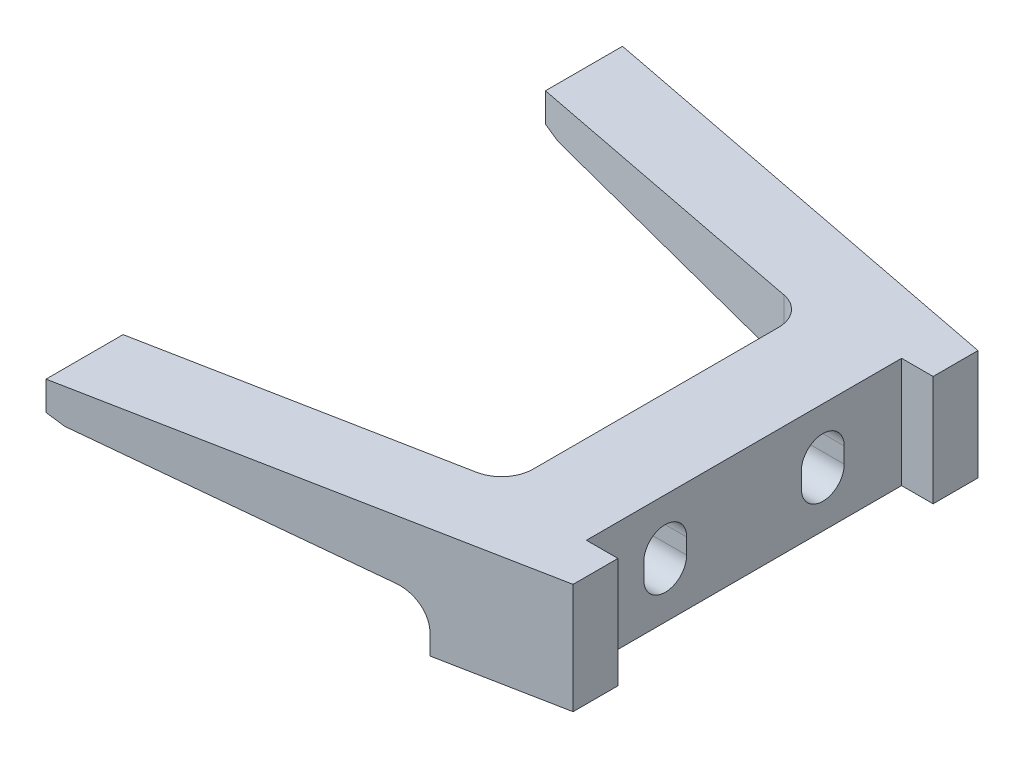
SolidWorks part; units mm, degrees
ref_plane "Front" through (0, 0, 0) normal (0, 0, 1) x (1, 0, 0)
ref_plane "Top" through (0, 0, 0) normal (0, 1, 0) x (1, 0, 0)
ref_plane "Right" through (0, 0, 0) normal (1, 0, 0) x (0, 0, -1)
sketch "Sketch1" plane through (0, 0, 0) normal (0, 0, 1) x (1, 0, 0)
  line L0 (0, -5.7912) -> (-35.56, -2.6801)
  line L1 (0, 0) -> (0, -5.7912)
  line L3 (-35.56, -2.6801) -> (-35.56, 0)
  line L4 (-35.56, 0) -> (0, 0)
  dimension "D1" = 35.56
  dimension "D2" = 5.7912
  dimension "D3" = 5
extrude "Extrude1" add sketch "Sketch1" along normal blind 25.4
sketch "Sketch3" plane through (0, 0, 0) normal (0, 1, 0) x (1, 0, 0)
  line L0 (0, -16.3159) -> (-46.7335, -25.4)
  line L1 (0, -25.4) -> (0, 0) construction
  line L2 (0, -25.4) -> (-35.56, -25.4) construction
  line L3 (-35.56, -17.018) -> (-9.652, -11.982)
  line L4 (-35.56, -25.4) -> (-35.56, 0) construction
  line L5 (-9.652, -11.982) -> (-9.652, 0)
  line L6 (0, 0) -> (-35.56, 0) construction
  line L7 (-9.652, 0) -> (-35.56, 0)
  line L8 (-35.56, -17.018) -> (-35.56, 0)
  line L9 (-46.7335, -25.4) -> (0, -25.4)
  line L10 (0, -25.4) -> (0, -16.3159)
  dimension "D1" = 6.096
  dimension "D2" = 17.018
  dimension "D3" = 9.652
  dimension "D5" = 79
extrude "Cut-Extrude1" cut sketch "Sketch3" against normal through all
mirror "Mirror1" about plane through (0, 0, 0) normal (0, 0, 1) of "Cut-Extrude1", "Extrude1"
sketch "Sketch4" plane through (0, 0, 0) normal (1, 0, 0) x (0, 0, -1)
  line L0 (-16.3159, 0) -> (16.3159, 0) construction
  line L5 (12.7, -9.7092) -> (0, -9.7092)
  line L6 (12.7, -9.7092) -> (12.7, 0)
  line L7 (12.7, 0) -> (0, 0)
  line L8 (0, -9.7092) -> (0, 0)
  dimension "D1" = 12.7
extrude "Cut-Extrude2" cut sketch "Sketch4" against normal blind 2.54
mirror "Mirror2" about plane through (0, 0, 0) normal (0, 0, 1) of "Cut-Extrude2"
sketch "Sketch7" plane through (0, 0, 0) normal (0, 1, 0) x (-1, 0, 0)
  line L0 (9.652, 11.982) -> (9.652, -11.982) construction
  line L1 (9.652, 18.1921) -> (0, 16.3159)
  line L2 (9.652, 18.1921) -> (9.652, 0)
  line L3 (9.652, 0) -> (2.54, 0)
  line L4 (2.54, 12.7) -> (2.54, 0)
  line L5 (2.54, -12.7) -> (2.54, 12.7) construction
  line L7 (0, 16.3159) -> (35.56, 23.2281) construction
  line L8 (2.54, 12.7) -> (0, 12.7)
  line L9 (0, 12.7) -> (0, 16.3159)
extrude "Extrude2" add sketch "Sketch7" against normal blind 8.89
fillet "Fillet3" radius 2.54 1 edges at (-9.652, -4.9468, 15.087)
mirror "Mirror3" about plane through (0, 0, 0) normal (0, 0, 1) of "Fillet3", "Extrude2"
chamfer "Chamfer1" distance 1.27 angle 15 2 edges at (-35.56, -2.6801, 20.123) (-35.56, -2.6801, -20.123)
fillet "Fillet1" radius 2.54 4 edges at (-10.3193, -5.5582, 12.1117) (-9.652, -3.6371, 11.982) (-9.652, -3.6371, -11.982)
hole_wizard "CBORE for #5 Socket Head Cap Screw2" positions "Sketch9" profile "Sketch8" counterbore size "#5" standard "Ansi Inch"
sketch "Sketch9" plane through (-9.652, 0, 0) normal (-1, 0, 0) x (0, 0, 1)
  line L0 (0, 0) -> (0, -8.89) construction
  line L1 (-17.0206, -8.89) -> (17.0206, -8.89) construction
  line L2 (-8.382, -4.445) -> (8.382, -4.445) construction
  point P0 (-8.382, -4.445)
  point P1 (8.382, -4.445)
  point P8 (0, -4.445)
  dimension "D1" = 16.764
sketch "Sketch8" plane through (-9.652, -4.445, -8.382) normal (0, 1, 0) x (0, 0, 1)
  line L0 (0, 0) -> (0, 9.652)
  line L1 (0, 9.652) -> (1.7272, 9.652)
  line L3 (1.7272, 9.652) -> (1.7272, 4.064)
  line L4 (1.7272, 4.064) -> (3.175, 4.064)
  line L5 (3.175, 4.064) -> (3.175, 0)
  line L7 (3.175, 0) -> (0, 0)
  line L11 (0, -6.35) -> (0, 107.95) construction
  dimension "Thru Hole Dia." = 3.4544
  dimension "Thru Hole Depth" = 9.652
  dimension "C'Bore Dia." = 6.35
  dimension "C'Bore Depth" = 4.064
sketch "Sketch10" [suppressed] plane through (-5.588, 0, 0) normal (-1, 0, 0) x (0, 0, 1)
  circle A0 centre (-8.382, -4.445) radius 3.175
  arc A1 (-9.4317, -7.4415) -> (-9.4317, -1.4485) centre (-8.382, -4.445) ccw construction
extrude "Cut-Extrude3" [suppressed] cut sketch "Sketch10" along normal through all
sketch "Sketch11" plane through (-2.54, 0, 0) normal (1, 0, 0) x (0, 0, -1)
  line L0 (-8.0772, -5.08) -> (-8.0772, -3.81)
  line L1 (-4.6228, -5.08) -> (-4.6228, -3.81)
  line L2 (-4.6228, 0) -> (-4.6228, -8.89) construction
  line L3 (12.7, 0) -> (-12.7, 0) construction
  line L4 (-12.7, -8.89) -> (12.7, -8.89) construction
  arc A0 (-8.0772, -5.08) -> (-4.6228, -5.08) centre (-6.35, -5.08) ccw
  arc A1 (-4.6228, -3.81) -> (-8.0772, -3.81) centre (-6.35, -3.81) ccw
  point P1 (-4.6228, -4.445)
  point P14 (-4.6228, -4.445)
  dimension "D1" = 3.4544
  dimension "D2" = 6.35
  dimension "D3" = 1.27
extrude "Cut-Extrude4" cut sketch "Sketch11" against normal through all
mirror "Mirror4" about plane through (0, 0, 0) normal (0, 0, 1) of "Cut-Extrude4"
